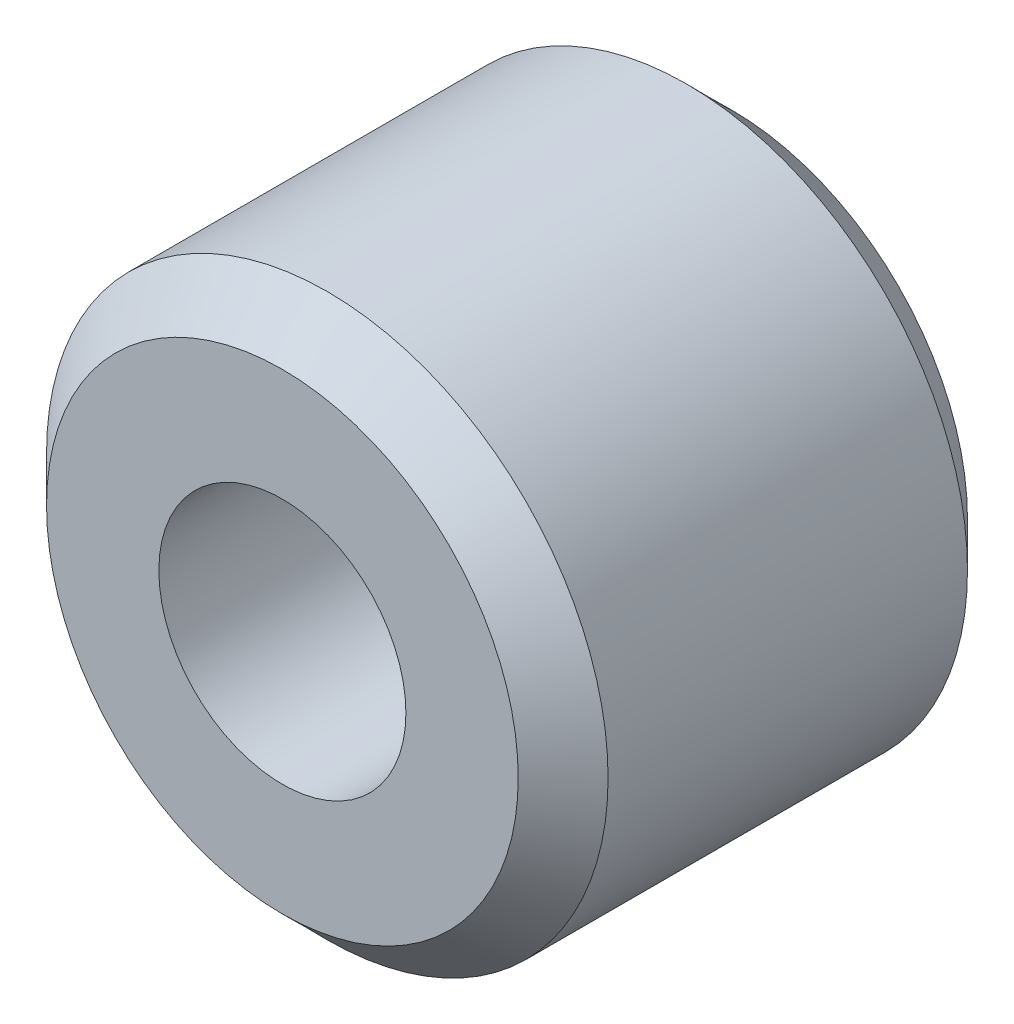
SolidWorks part; units mm, degrees
ref_plane "Plan de face" through (0, 0, 0) normal (0, 0, 1) x (1, 0, 0)
ref_plane "Plan de dessus" through (0, 0, 0) normal (0, 1, 0) x (1, 0, 0)
ref_plane "Plan de droite" through (0, 0, 0) normal (1, 0, 0) x (0, 0, -1)
sketch "Esquisse1" plane through (0, 0, 0) normal (0, 0, 1) x (1, 0, 0)
  circle A0 centre (0, 0) radius 12.5
  dimension "D1" = 25
extrude "Boss.-Extru.1" add sketch "Esquisse1" along normal blind 20
chamfer "Chanfrein1" distance 2 angle 45 2 edges at (12.5, 0, 0) (12.5, 0, 20)
sketch "Esquisse2" plane through (0, 0, 20) normal (0, 0, 1) x (1, 0, 0)
  circle A0 centre (0, 0) radius 5.5
  dimension "D1" = 11
extrude "Enlèv. mat.-Extru.1" cut sketch "Esquisse2" against normal up to surface (20 mm away)
